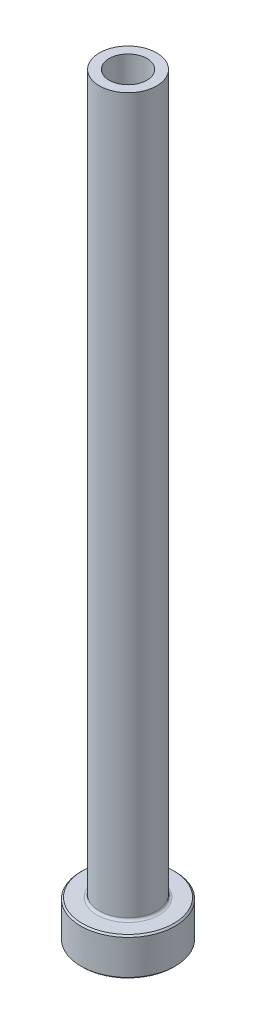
SolidWorks part; units mm, degrees
ref_plane "Front Plane" through (0, 0, 0) normal (0, 0, 1) x (1, 0, 0)
ref_plane "Top Plane" through (0, 0, 0) normal (0, 1, 0) x (1, 0, 0)
ref_plane "Right Plane" through (0, 0, 0) normal (1, 0, 0) x (0, 0, -1)
sketch "Sketch1" plane through (0, 0, 0) normal (0, 0, 1) x (1, 0, 0)
  line L0 (0, 0) -> (0, 50000) construction
  line L1 (0, 0) -> (7.9375, 0)
  line L2 (7.9375, 0) -> (7.9375, 6.35)
  line L3 (7.9375, 6.35) -> (5.2165, 6.35)
  line L4 (4.8197, 6.7469) -> (4.8197, 127)
  line L5 (4.8197, 127) -> (0, 127)
  line L6 (0, 127) -> (0, 0)
  arc A0 (4.8197, 6.7469) -> (5.2165, 6.35) centre (5.2165, 6.7469) ccw
  dimension "D5" = 0.3969
  dimension "D1" = 9.6393
  dimension "D2" = 15.875
  dimension "D3" = 6.35
  dimension "D4" = 127
revolve "Revolve1" add sketch "Sketch1" angle 360 about L0
sketch "Sketch2" plane through (0, 0, 0) normal (0, 0, 1) x (1, 0, 0)
  line L0 (0, 0) -> (0, 50000) construction
  line L1 (-7.9375, 0) -> (7.9375, 0) construction
  line L2 (3.7624, 0) -> (3.3655, 0.3969)
  line L3 (3.3655, 0.3969) -> (3.3655, 52.5145)
  line L4 (3.3655, 52.5145) -> (3.175, 66.802)
  line L5 (3.175, 66.802) -> (3.175, 127)
  line L6 (4.8197, 127) -> (-4.8197, 127) construction
  line L7 (3.175, 127) -> (0, 127)
  line L8 (0, 127) -> (0, 0)
  line L9 (0, 0) -> (3.7624, 0)
  point P4 (0, 0)
  dimension "D1" = 0.3969
  dimension "D2" = 45
  dimension "D3" = 6.35
  dimension "D4" = 6.731
  dimension "D5" = 60.198
  dimension "D6" = 14.2875
revolve "Cut-Revolve1" cut sketch "Sketch2" angle 360 about L0
chamfer "Chamfer1" distance 0.254 angle 45 2 edges at (0, 0, -7.9375) (0, 6.35, -7.9375)
